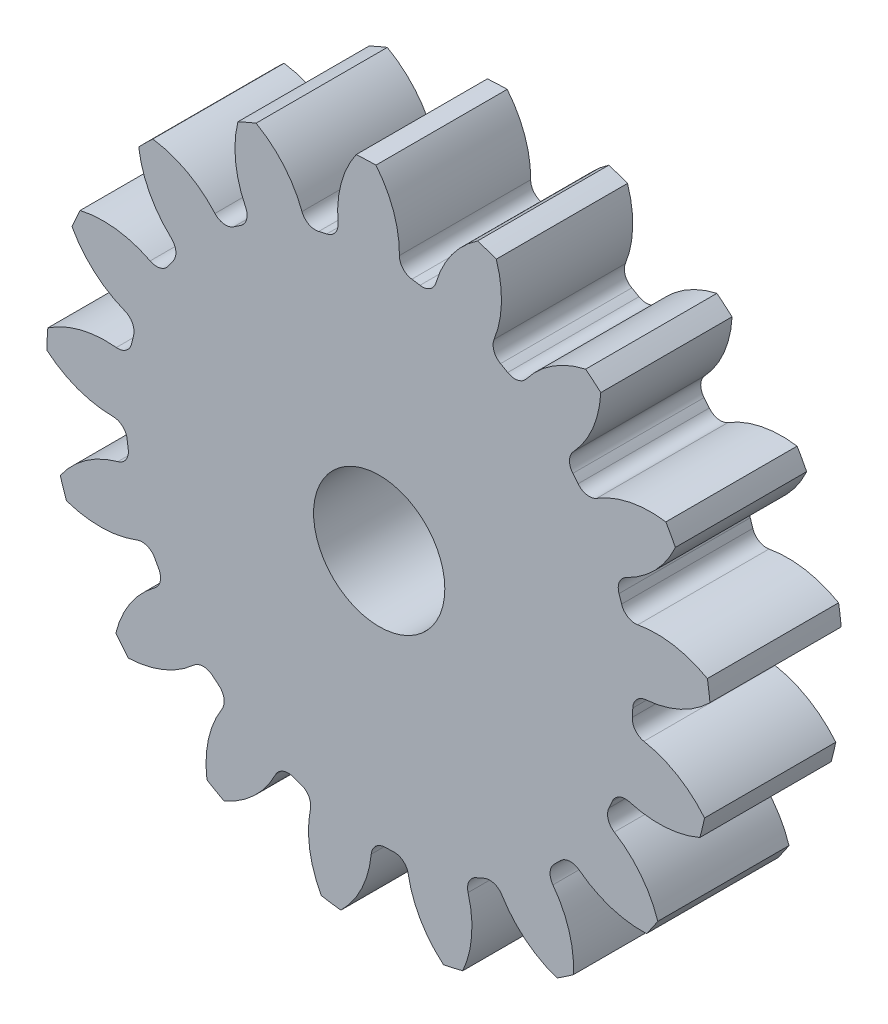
SolidWorks part; units mm, degrees
ref_plane "Front" through (0, 0, 0) normal (0, 0, 1) x (1, 0, 0)
ref_plane "Top" through (0, 0, 0) normal (0, 1, 0) x (1, 0, 0)
ref_plane "Right" through (0, 0, 0) normal (1, 0, 0) x (0, 0, -1)
sketch "Sketch3" plane through (0, 0, 0) normal (0, 0, 1) x (1, 0, 0)
  circle A0 centre (0, 0) radius 321.7333
  dimension "od" = 643.4667
extrude "gearBody" add sketch "Sketch3" along normal blind 127
sketch "Sketch2" plane through (0, 0, 0) normal (0, 0, 1) x (1, 0, 0)
  line L0 (0, 0) -> (249.9151, 103.5182) construction
  line L1 (316.2956, -68.2706) -> (0, 0) construction
  line L2 (0, 0) -> (36.3143, 0) construction
  line L3 (287.643, 11.3467) -> (284.8402, -41.6325) construction
  line L5 (286.2416, -15.1429) -> (0, 0) construction
  line L7 (0, 0) -> (270.5062, 0) construction
  arc A0 (270.4383, 6.0616) -> (268.2892, -34.5617) centre (0, 0) ccw construction
  arc A1 (320.0557, 32.8126) -> (314.8072, -66.3985) centre (0, 0) ccw construction
  arc A2 (287.643, 11.3467) -> (284.8402, -41.6325) centre (0, 0) ccw construction
  arc A3 (244.9469, -16.9596) -> (245.3691, -8.9793) centre (0, 0) ccw
  arc A4 (316.2956, -68.2706) -> (256.1326, -31.4546) centre (237.598, -129.3089) ccw
  arc A5 (316.2956, -68.2706) -> (321.7333, 34.5173) centre (0, 0) ccw
  arc A6 (321.7333, 34.5173) -> (258.0217, 4.2546) centre (249.9151, 103.5182) cw
  arc A7 (245.3691, -8.9793) -> (258.0217, 4.2546) centre (259.1436, -9.4834) cw
  arc A8 (256.1326, -31.4546) -> (244.9469, -16.9596) centre (258.6977, -17.9117) cw
  point P6 (321.7333, 34.5173)
  point P22 (316.2956, -68.2706)
  dimension "baseDia" = 541.0124
  dimension "od" = 643.4667
  dimension "pd" = 575.7333
  dimension "rd" = 491.0667
  dimension "rFillet" = 13.7837
  dimension "pointX" = 321.7333
  dimension "pointY" = 34.5173
  dimension "CTT" = 52.9791
  dimension "flankCenterAngle" = 22.5
extrude "toothCut" cut sketch "Sketch2" along normal through all
pattern_circular "CirPattern1" count 17 over 360 about axis through (0, 0, 0) along (0, 0, 1) of "toothCut"
sketch "hub1Dia" plane through (0, 0, 0) normal (0, 0, -1) x (-1, 0, 0)
  circle A0 centre (0, 0) radius 12.7
  dimension "hub1Dia" = 25.4
sketch "hub2Dia" plane through (0, 0, 127) normal (0, 0, 1) x (1, 0, 0)
  circle A0 centre (0, 0) radius 12.7
  dimension "hub2dia" = 25.4
sketch "boreDia" plane through (0, 0, 0) normal (0, 0, 1) x (1, 0, 0)
  circle A0 centre (0, 0) radius 63.5
  dimension "boreDia" = 127
extrude "bore" cut sketch "boreDia" against normal mid plane 25400
